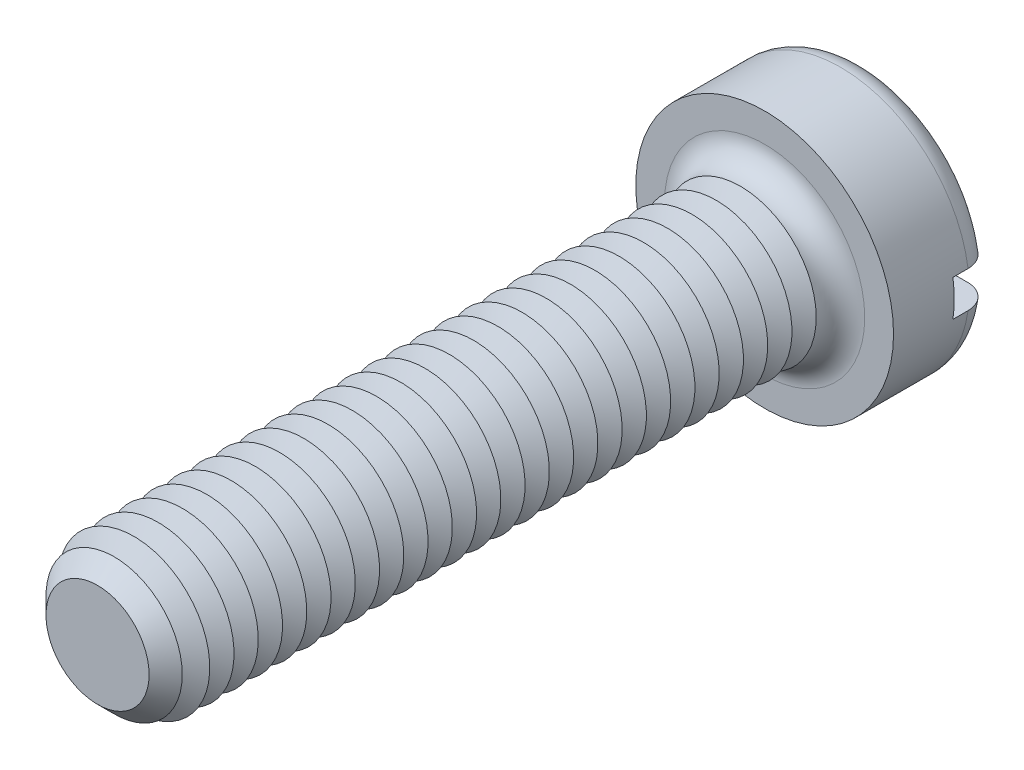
SolidWorks part; units mm, degrees
ref_plane "Front Plane" through (0, 0, 0) normal (0, 0, 1) x (1, 0, 0)
ref_plane "Top Plane" through (0, 0, 0) normal (0, 1, 0) x (1, 0, 0)
ref_plane "Right Plane" through (0, 0, 0) normal (1, 0, 0) x (0, 0, -1)
sketch "Sketch3" plane through (0, 0, 0) normal (0, 0, 1) x (1, 0, 0)
  circle A0 centre (0, 0) radius 4.25
  dimension "D1" = 8.5
extrude "Boss-Extrude2" add sketch "Sketch3" against normal blind 3.3
sketch "Sketch4" plane through (0, 0, 0) normal (0, 0, 1) x (1, 0, 0)
  circle A0 centre (0, 0) radius 2.5
  dimension "D1" = 5
extrude "Boss-Extrude3" add sketch "Sketch4" along normal blind 22
fillet "Fillet1" radius 0.8 2 edges at (4.25, 0, -3.3) (2.5, 0, 0)
chamfer "Chamfer1" distance 0.8 angle 45 1 edges at (2.5, 0, 22)
sketch "Sketch5" plane through (0, 0, 0) normal (1, 0, 0) x (0, 0, -1)
  line L0 (1.6944, 0) -> (-7.6738, 0) construction
sketch "Sketch6" plane through (0, 0, 0) normal (1, 0, 0) x (0, 0, -1)
  line L0 (-0.8, 2.5) -> (-1.2, 1.8072)
  line L1 (-1.2, 1.8072) -> (-1.6, 2.5)
  line L2 (-0.8, 2.5) -> (-21.2, 2.5) construction
  line L3 (-1.6, 2.5) -> (-0.8, 2.5)
  dimension "D1" = 0.8
revolve "Cut-Revolve1" cut sketch "Sketch6" angle 360 about L0
pattern_linear "LPattern1" count 27 spacing 0.8 along (0, 0, 1) of "Cut-Revolve1"
sketch "Sketch8" plane through (0, 0, -3.3) normal (0, 0, -1) x (-1, 0, 0)
  line L1 (4.25, -0.6) -> (-4.25, -0.6)
  line L2 (4.25, -0.6) -> (4.25, 0.6)
  line L3 (4.25, 0.6) -> (-4.25, 0.6)
  line L4 (-4.25, -0.6) -> (-4.25, 0.6)
  line L5 (4.25, -0.6) -> (-4.25, 0.6) construction
  line L6 (4.25, 0.6) -> (-4.25, -0.6) construction
  point P0 (0, 0)
  dimension "D1" = 8.5
  dimension "D2" = 1.2
extrude "Cut-Extrude1" cut sketch "Sketch8" against normal blind 1.3
